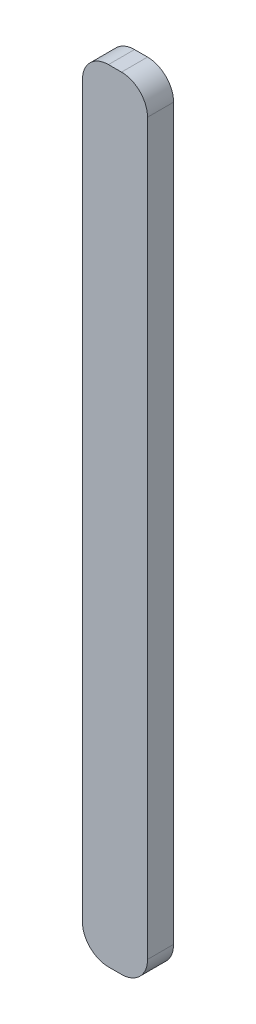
SolidWorks part; units mm, degrees
ref_plane "Alzado" through (0, 0, 0) normal (0, 0, 1) x (1, 0, 0)
ref_plane "Planta" through (0, 0, 0) normal (0, 1, 0) x (1, 0, 0)
ref_plane "Vista lateral" through (0, 0, 0) normal (1, 0, 0) x (0, 0, -1)
sketch "Croquis1" plane through (0, 0, 0) normal (0, 0, 1) x (1, 0, 0)
  line L1 (-2.5, 150) -> (2.5, 150)
  line L2 (-12.5, 140) -> (-12.5, -140)
  line L3 (-2.5, -150) -> (2.5, -150)
  line L4 (12.5, 140) -> (12.5, -140)
  line L5 (-12.5, 150) -> (12.5, -150) construction
  line L6 (-12.5, -150) -> (12.5, 150) construction
  arc A0 (2.5, -150) -> (12.5, -140) centre (2.5, -140) ccw
  arc A1 (-2.5, -150) -> (-12.5, -140) centre (-2.5, -140) cw
  arc A2 (12.5, 140) -> (2.5, 150) centre (2.5, 140) ccw
  arc A3 (-12.5, 140) -> (-2.5, 150) centre (-2.5, 140) cw
  point P0 (0, 0)
  dimension "D3" = 10
  dimension "D1" = 300
  dimension "D2" = 25
extrude "Saliente-Extruir1" add sketch "Croquis1" along normal blind 10
